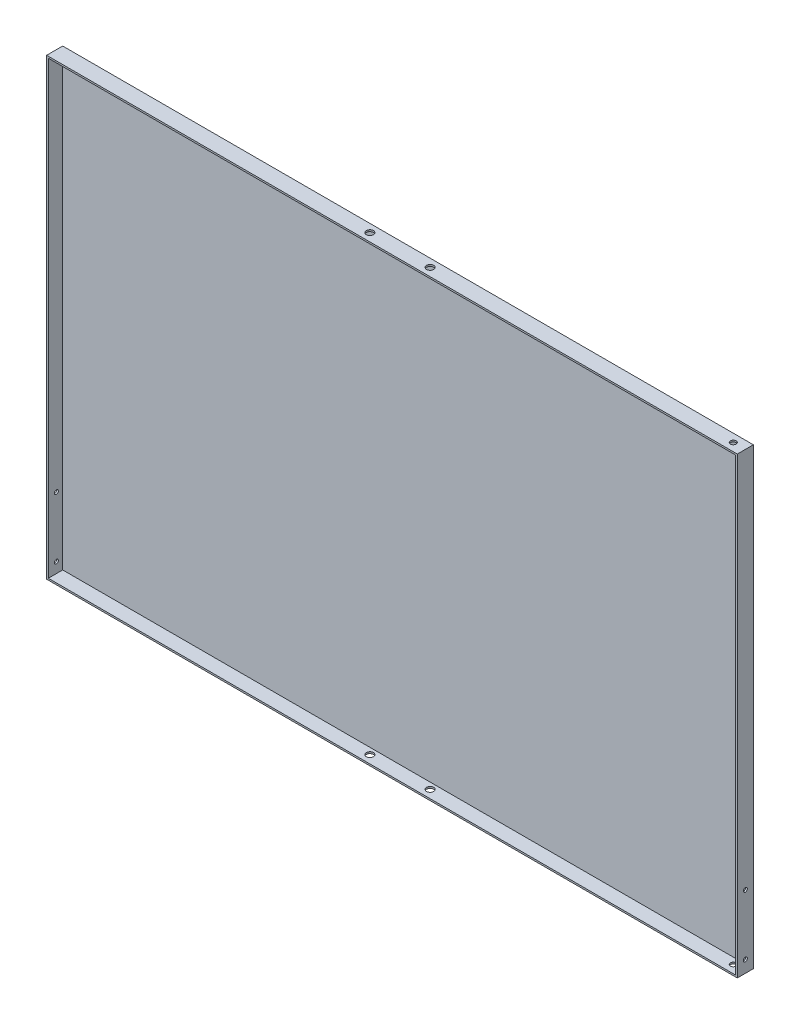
SolidWorks part; units mm, degrees
ref_plane "Plan de face" through (0, 0, 0) normal (0, 0, 1) x (1, 0, 0)
ref_plane "Plan de dessus" through (0, 0, 0) normal (0, 1, 0) x (1, 0, 0)
ref_plane "Plan de droite" through (0, 0, 0) normal (1, 0, 0) x (0, 0, -1)
sketch "Esquisse1" plane through (0, 0, 0) normal (0, 0, 1) x (1, 0, 0)
  line L1 (860, -565) -> (-860, -565)
  line L2 (860, -565) -> (860, 565)
  line L3 (860, 565) -> (-860, 565)
  line L4 (-860, -565) -> (-860, 565)
  line L5 (860, -565) -> (-860, 565) construction
  line L6 (860, 565) -> (-860, -565) construction
  point P0 (0, 0)
  dimension "D1" = 1720
  dimension "D2" = 1130
extrude "Boss.-Extru.1" add sketch "Esquisse1" along normal blind 40
shell "Coque1" thickness 4.2244
sketch "Esquisse2" plane through (0, 565, 0) normal (0, 1, 0) x (1, 0, 0)
  line L0 (860, -40) -> (860, 0) construction
  line L1 (860, 0) -> (-860, 0) construction
  line L2 (0, 0) -> (0, -127.2039) construction
  circle A0 centre (830, -20) radius 7.1802
  circle A1 centre (-75, -20) radius 8.9525
  circle A2 centre (75, -20) radius 8.9525
  dimension "D1" = 30
  dimension "D2" = 20
  dimension "D3" = 150
  dimension "D4" = 20
extrude "Enlèv. mat.-Extru.1" cut sketch "Esquisse2" against normal through all
sketch "Esquisse3" plane through (-860, 0, 0) normal (-1, 0, 0) x (0, 0, 1)
  line L0 (40, -565) -> (0, -565) construction
  line L1 (0, 565) -> (0, -565) construction
  circle A0 centre (20, -535) radius 5
  circle A1 centre (20, -385) radius 5
  dimension "D2" = 10
  dimension "D3" = 150
  dimension "D4" = 30
  dimension "D5" = 20
  dimension "D1" = 2
extrude "Enlèv. mat.-Extru.2" cut sketch "Esquisse3" against normal through all both and the other way through all
